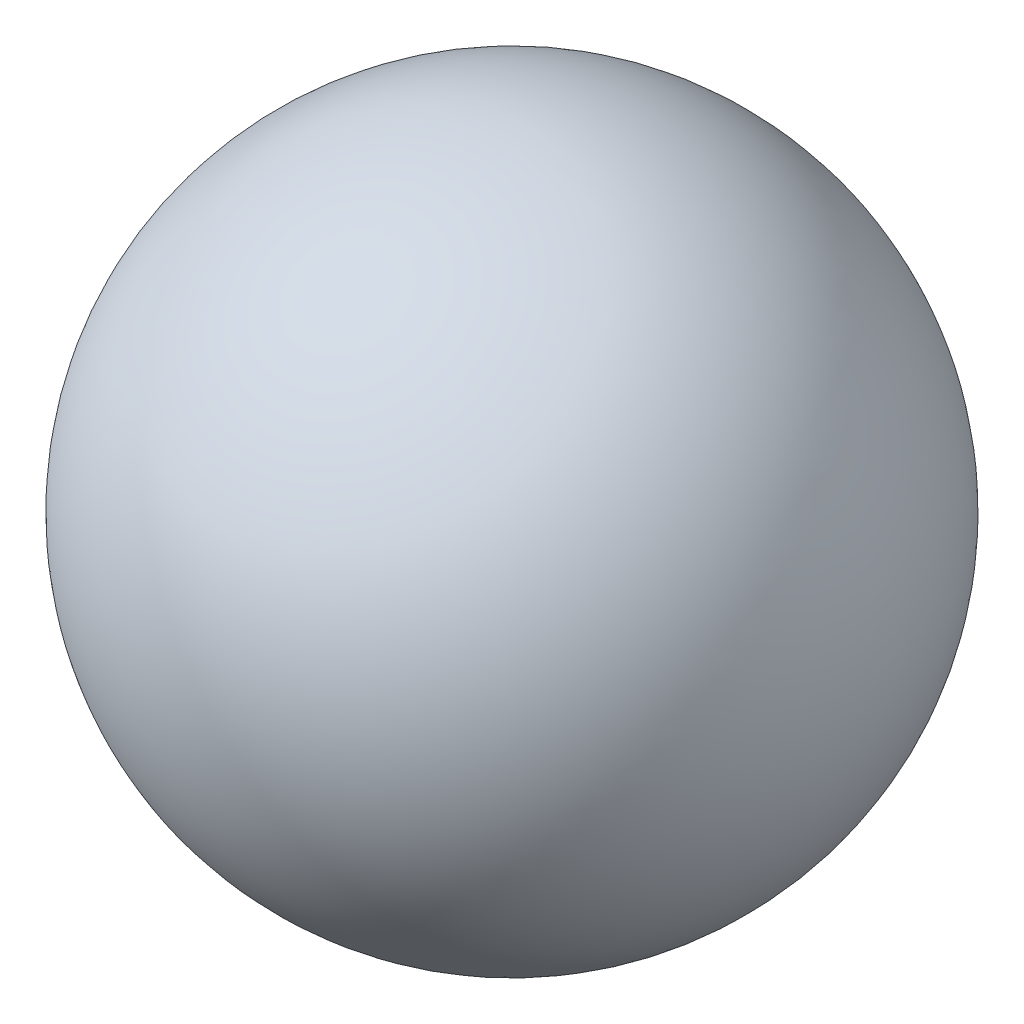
SolidWorks part; units mm, degrees
ref_plane "前视基准面" through (0, 0, 0) normal (0, 0, 1) x (1, 0, 0)
ref_plane "上视基准面" through (0, 0, 0) normal (0, 1, 0) x (1, 0, 0)
ref_plane "右视基准面" through (0, 0, 0) normal (1, 0, 0) x (0, 0, -1)
other "Configuration Table"
sketch "草图1" plane through (0, 0, 0) normal (0, 1, 0) x (1, 0, 0)
  line L0 (0, 50) -> (0, -50) construction
  circle A0 centre (0, 0) radius 50
revolve "旋转3" add sketch "草图1" angle 360 about L0
